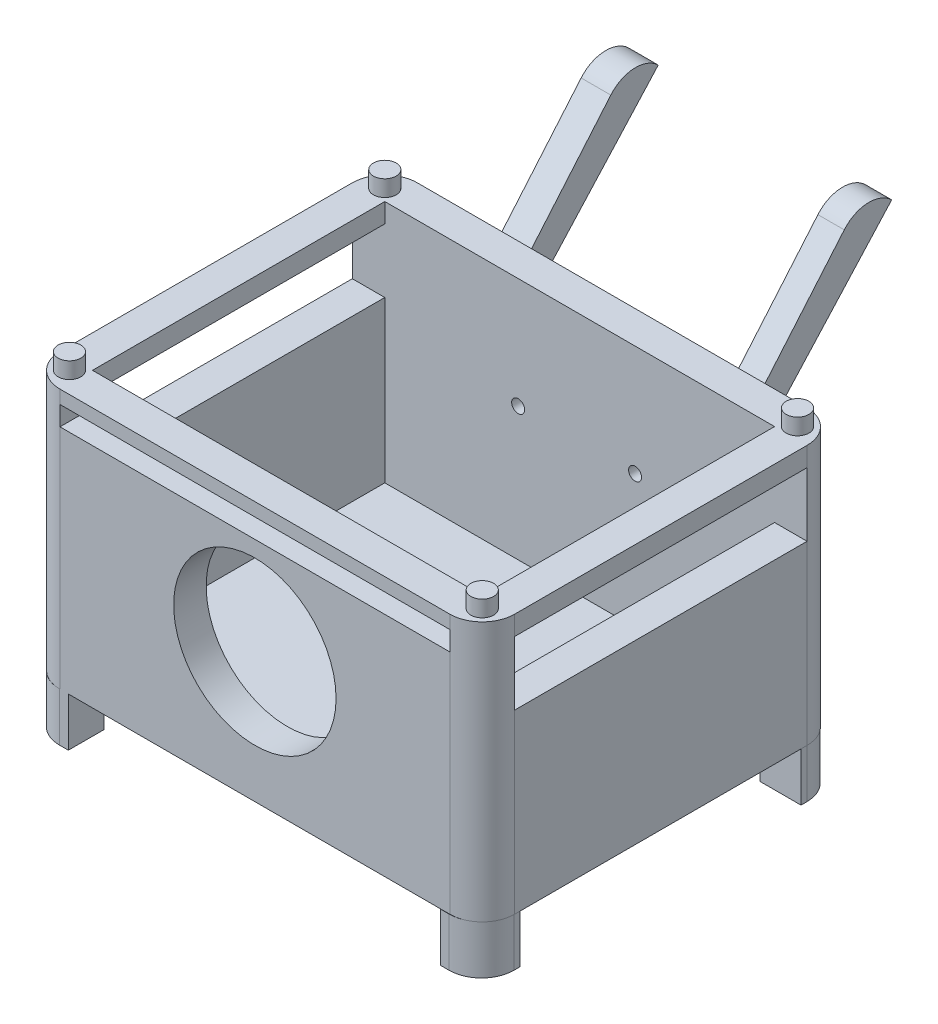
SolidWorks part; units mm, degrees
ref_plane "Plan de face" through (0, 0, 0) normal (0, 0, 1) x (1, 0, 0)
ref_plane "Plan de dessus" through (0, 0, 0) normal (0, 1, 0) x (1, 0, 0)
ref_plane "Plan de droite" through (0, 0, 0) normal (1, 0, 0) x (0, 0, -1)
sketch "Esquisse1" plane through (0, 0, 0) normal (0, 1, 0) x (1, 0, 0)
  line L1 (-51.1881, 24.7283) -> (88.8119, 24.7283)
  line L2 (-51.1881, 24.7283) -> (-51.1881, -85.2717)
  line L3 (-51.1881, -85.2717) -> (88.8119, -85.2717)
  line L4 (88.8119, 24.7283) -> (88.8119, -85.2717)
  dimension "D1" = 140
  dimension "D2" = 110
extrude "Boss.-Extru.1" add sketch "Esquisse1" along normal blind 5
sketch "Esquisse2" plane through (0, 5, 0) normal (0, 1, 0) x (1, 0, 0)
  line L0 (-51.1881, -85.2717) -> (88.8119, -85.2717) construction
  line L1 (-51.1881, 24.7283) -> (-41.1881, 24.7283)
  line L2 (-51.1881, 24.7283) -> (-51.1881, -85.2717)
  line L3 (-51.1881, -85.2717) -> (-41.1881, -85.2717)
  line L4 (-41.1881, 24.7283) -> (-41.1881, -85.2717)
  dimension "D1" = 10
extrude "Boss.-Extru.2" add sketch "Esquisse2" along normal blind 75
sketch "Esquisse3" plane through (0, 5, 0) normal (0, 1, 0) x (1, 0, 0)
  line L0 (88.8119, -85.2717) -> (88.8119, 24.7283) construction
  line L1 (-41.1881, -85.2717) -> (88.8119, -85.2717)
  line L2 (-41.1881, -85.2717) -> (-41.1881, -75.2717)
  line L3 (-41.1881, -75.2717) -> (88.8119, -75.2717)
  line L4 (88.8119, -85.2717) -> (88.8119, -75.2717)
  dimension "D1" = 10
extrude "Boss.-Extru.3" add sketch "Esquisse3" along normal blind 75
sketch "Esquisse4" plane through (0, 5, 0) normal (0, 1, 0) x (1, 0, 0)
  line L0 (88.8119, 24.7283) -> (-41.1881, 24.7283) construction
  line L1 (88.8119, -75.2717) -> (78.8119, -75.2717)
  line L2 (88.8119, -75.2717) -> (88.8119, 24.7283)
  line L3 (88.8119, 24.7283) -> (78.8119, 24.7283)
  line L4 (78.8119, -75.2717) -> (78.8119, 24.7283)
  dimension "D1" = 10
extrude "Boss.-Extru.4" add sketch "Esquisse4" along normal blind 75
sketch "Esquisse6" plane through (0, 5, 0) normal (0, 1, 0) x (1, 0, 0)
  line L0 (-41.1881, 24.7283) -> (-41.1881, 14.7283) construction
  line L1 (-41.1881, -75.2717) -> (-41.1881, 24.7283) construction
  line L2 (78.8119, 14.7283) -> (78.8119, 24.7283) construction
  line L3 (78.8119, 24.7283) -> (78.8119, -75.2717) construction
  line L4 (78.8119, 24.7283) -> (-41.1881, 24.7283) construction
sketch "Esquisse8" plane through (0, 0, 85.2717) normal (0, 0, 1) x (1, 0, 0)
  line L0 (-51.1881, 40) -> (18.8119, 40) construction
  line L1 (-51.1881, 80) -> (-51.1881, 0) construction
  circle A0 centre (18.8119, 40) radius 25
extrude "Enlèv. mat.-Extru.1" cut sketch "Esquisse8" against normal blind 10
sketch "Esquisse9" plane through (0, 5, 0) normal (0, 1, 0) x (1, 0, 0)
  circle A0 centre (-1.36, -15.2778) radius 1.5
  circle A1 centre (38.64, -15.2778) radius 1.5
  circle A2 centre (-1.36, -67.3569) radius 1.4364
  circle A3 centre (38.64, -67.3569) radius 1.5
extrude "Enlèv. mat.-Extru.3" cut sketch "Esquisse9" against normal blind 16
fillet "Congé1" radius 10 2 edges at (88.8119, 40, 85.2717) (-51.1881, 40, 85.2717)
fillet "Congé2" radius 10 2 edges at (-51.1881, 40, -24.7283) (88.8119, 40, -24.7283)
sketch "Esquisse15" plane through (0, 5, 0) normal (0, 1, 0) x (1, 0, 0)
  line L1 (-41.1881, 24.7283) -> (78.8119, 24.7283)
  line L2 (-41.1881, 24.7283) -> (-41.1881, 14.7283)
  line L3 (-41.1881, 14.7283) -> (78.8119, 14.7283)
  line L4 (78.8119, 24.7283) -> (78.8119, 14.7283)
extrude "Boss.-Extru.8" add sketch "Esquisse15" along normal blind 75
sketch "Esquisse16" plane through (0, 0, 0) normal (0, -1, 0) x (1, 0, 0)
  line L0 (-41.1881, 85.2717) -> (78.8119, 85.2717) construction
  line L1 (-51.2741, 74.2411) -> (-38.6115, 74.2411)
  line L2 (-51.2741, 74.2411) -> (-51.2741, 85.2717)
  line L3 (-51.2741, 85.2717) -> (-38.6115, 85.2717)
  line L4 (-38.6115, 74.2411) -> (-38.6115, 85.2717)
extrude "Boss.-Extru.9" add sketch "Esquisse16" along normal blind 15 contours L2 L1 L4 L3
fillet "Congé3" radius 10 1 edges at (-51.2741, -7.5, 85.2717)
sketch "Esquisse17" plane through (0, 0, 0) normal (0, -1, 0) x (1, 0, 0)
sketch "Esquisse18" plane through (0, 0, 0) normal (0, -1, 0) x (1, 0, 0)
  line L0 (88.8029, -12.8695) -> (76.2445, -12.8695)
  line L1 (-38.6115, -12.7222) -> (-51.1699, -12.7222)
  line L2 (-38.6115, -12.7222) -> (-38.6115, -24.5014)
  line L3 (-38.6115, -24.5014) -> (-51.1699, -24.5014)
  line L4 (-51.1699, -12.7222) -> (-51.1699, -24.5014)
  line L5 (88.8029, -12.8695) -> (88.8029, -24.6486)
  line L6 (88.8029, -24.6486) -> (76.2445, -24.6486)
  line L7 (76.2445, -12.8695) -> (76.2445, -24.6486)
  line L8 (88.6556, 85.3394) -> (76.0972, 85.3394)
  line L9 (88.6556, 85.3394) -> (88.6556, 73.5602)
  line L10 (88.6556, 73.5602) -> (76.0972, 73.5602)
  line L11 (76.0972, 85.3394) -> (76.0972, 73.5602)
extrude "Boss.-Extru.10" add sketch "Esquisse18" along normal blind 15
fillet "Congé4" radius 10 3 edges at (-51.1699, -7.5, -24.5014) (88.8029, -7.5, -24.6486) (88.6556, -7.5, 85.3394)
sketch "Esquisse19" plane through (0, 0, -14.7283) normal (0, 0, 1) x (1, 0, 0)
  circle A0 centre (35.8665, 45.9752) radius 2
  circle A1 centre (-0.1335, 45.9752) radius 2
extrude "Enlèv. mat.-Extru.4" cut sketch "Esquisse19" against normal blind 15
sketch "Esquisse22" plane through (0, 80, 0) normal (0, 1, 0) x (1, 0, 0)
  circle A0 centre (-44.7236, 18.2638) radius 3.5
  circle A1 centre (82.3475, 18.2638) radius 3.5
  circle A4 centre (82.3475, -78.8073) radius 3.5
  circle A7 centre (-44.7236, -78.8073) radius 3.5
extrude "Boss.-Extru.12" add sketch "Esquisse22" along normal blind 5
sketch "Esquisse23" plane through (0, 0, -24.7283) normal (0, 0, -1) x (-1, 0, 0)
  line L0 (-78.8119, 80) -> (41.1881, 80) construction
  line L1 (-65.8597, 80) -> (-57.7456, 80)
  line L2 (-65.8597, 80) -> (-65.8597, 66.4136)
  line L3 (-65.8597, 66.4136) -> (-57.7456, 66.4136)
  line L4 (-57.7456, 80) -> (-57.7456, 66.4136)
  line L6 (6.0081, 66.4136) -> (15.1365, 66.4136)
  line L7 (6.0081, 66.4136) -> (6.0081, 80)
  line L8 (6.0081, 80) -> (15.1365, 80)
  line L9 (15.1365, 66.4136) -> (15.1365, 80)
extrude "Boss.-Extru.13" add sketch "Esquisse23" along normal blind 39
sketch "Esquisse24" plane through (0, 80, 0) normal (0, 1, 0) x (1, 0, 0)
  line L1 (-15.1365, 24.7283) -> (-6.0081, 24.7283)
  line L2 (-15.1365, 24.7283) -> (-15.1365, 63.7283)
  line L3 (-15.1365, 63.7283) -> (-6.0081, 63.7283)
  line L4 (-6.0081, 24.7283) -> (-6.0081, 63.7283)
  line L5 (57.7456, 63.7283) -> (65.8597, 63.7283)
  line L6 (57.7456, 63.7283) -> (57.7456, 24.7283)
  line L7 (57.7456, 24.7283) -> (65.8597, 24.7283)
  line L8 (65.8597, 63.7283) -> (65.8597, 24.7283)
extrude "Boss.-Extru.14" add sketch "Esquisse24" along normal blind 46
sketch "Esquisse25" plane through (65.8597, 0, 0) normal (1, 0, 0) x (0, 0, -1)
  line L0 (24.7283, 80) -> (63.7283, 126)
  line L1 (63.7283, 126) -> (63.7283, 66.4136) construction
  line L2 (24.7283, 80) -> (24.7283, 126)
  line L3 (24.7283, 126) -> (63.7283, 126)
extrude "Enlèv. mat.-Extru.5" cut sketch "Esquisse25" against normal blind 112
sketch "Esquisse26" plane through (65.8597, 0, 0) normal (1, 0, 0) x (0, 0, -1)
  line L0 (24.7283, 66.4136) -> (63.7283, 109.478)
  line L1 (63.7283, 126) -> (63.7283, 66.4136) construction
  line L2 (63.7283, 109.478) -> (63.7283, 66.4136)
  line L3 (63.7283, 66.4136) -> (24.7283, 66.4136)
extrude "Enlèv. mat.-Extru.6" cut sketch "Esquisse26" against normal blind 112
fillet "Congé6" radius 10 2 edges at (-10.5723, 126, -63.7283) (61.8027, 126, -63.7283)
sketch "Esquisse27" plane through (-51.1881, 0, 0) normal (-1, 0, 0) x (0, 0, 1)
  line L0 (-14.7283, 80) -> (-14.7283, 0) construction
  line L1 (-14.7283, 74.0459) -> (75.2717, 74.0459)
  line L2 (-14.7283, 74.0459) -> (-14.7283, 54.4217)
  line L3 (-14.7283, 54.4217) -> (75.2717, 54.4217)
  line L4 (75.2717, 74.0459) -> (75.2717, 54.4217)
  line L5 (75.2717, 0) -> (75.2717, 80) construction
extrude "Enlèv. mat.-Extru.7" cut sketch "Esquisse27" against normal blind 198
sketch "Esquisse28" plane through (0, 0, 85.2717) normal (0, 0, 1) x (1, 0, 0)
  line L0 (-41.1881, 80) -> (-41.1881, 0) construction
  line L1 (-41.1881, 75.9029) -> (78.8119, 75.9029)
  line L2 (-41.1881, 75.9029) -> (-41.1881, 69.9355)
  line L3 (-41.1881, 69.9355) -> (78.8119, 69.9355)
  line L4 (78.8119, 75.9029) -> (78.8119, 69.9355)
  line L5 (78.8119, 0) -> (78.8119, 80) construction
extrude "Enlèv. mat.-Extru.8" cut sketch "Esquisse28" against normal blind 49
